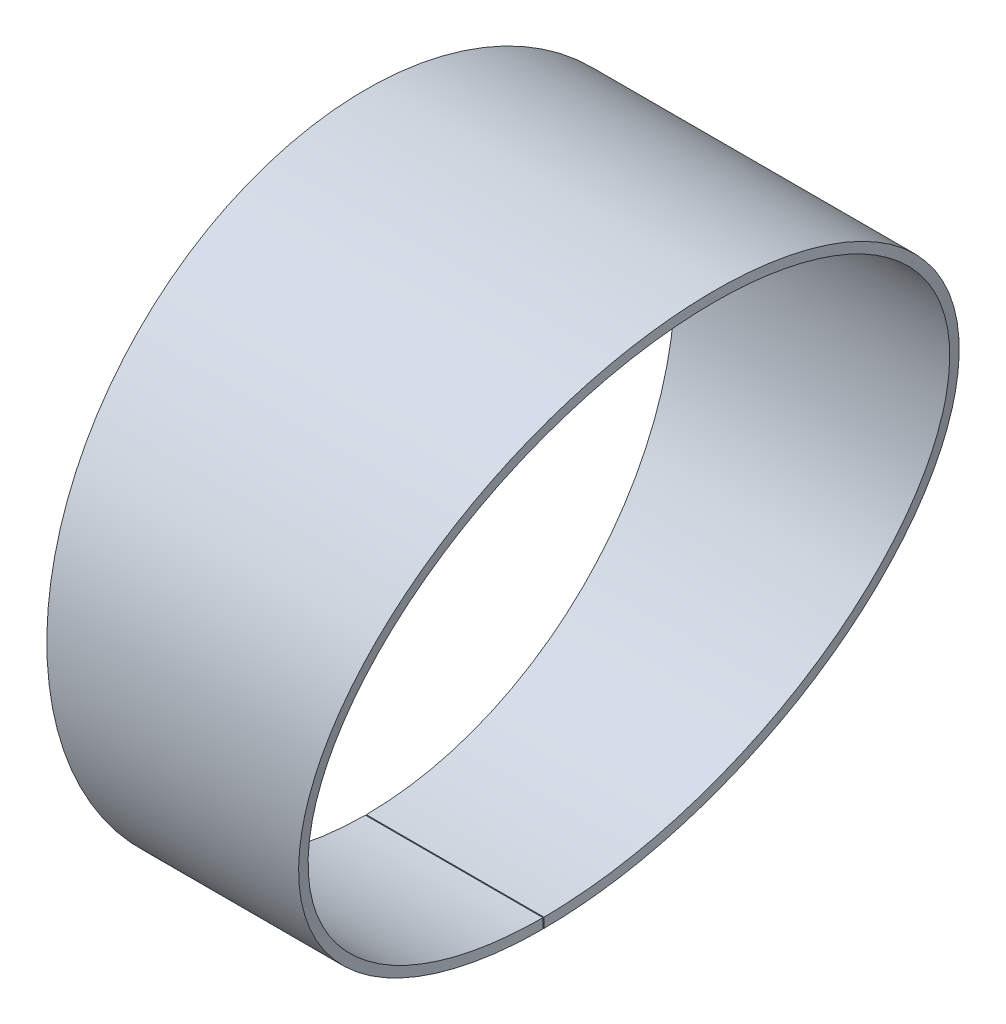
SolidWorks part; units mm, degrees
ref_plane "前视基准面" through (0, 0, 0) normal (0, 0, 1) x (1, 0, 0)
ref_plane "上视基准面" through (0, 0, 0) normal (0, 1, 0) x (1, 0, 0)
ref_plane "右视基准面" through (0, 0, 0) normal (1, 0, 0) x (0, 0, -1)
imported_body "基体零件-圆管斜插四节直角弯头-1"
sheet metal parameters "钣金1" parameters "D1"=0.7366, "厚度"=10
bend "圆角折弯1" bend radius 315 bend angle 359.824 parameters "D5"=1
flatten bends "展开-折弯1"
sketch "尖角-草图1" plane through (-909.5671, 675.0004, 0.5) normal (0, -1, 0.0015) x (1, 0, 0)
  line L0 (-90.4329, 989.1171) -> (90.4329, 989.1171) construction
  dimension "D1" = 0
process bends "加工-折弯1" parameters "D1"=0
sketch "平面-草图1" plane through (-909.5671, 675.0004, 0.5) normal (0, -1, 0.0015) x (1, 0, 0)
